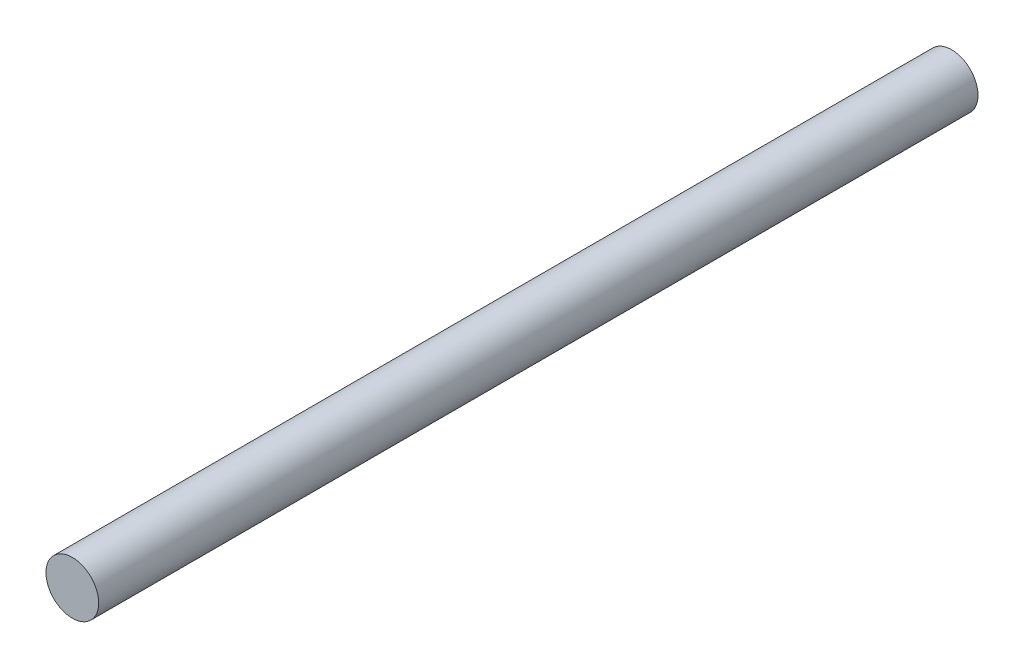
SolidWorks part; units mm, degrees
ref_plane "Front Plane" through (0, 0, 0) normal (0, 0, 1) x (1, 0, 0)
ref_plane "Top Plane" through (0, 0, 0) normal (0, 1, 0) x (1, 0, 0)
ref_plane "Right Plane" through (0, 0, 0) normal (1, 0, 0) x (0, 0, -1)
sketch "Sketch1" plane through (0, 0, 0) normal (0, 0, 1) x (1, 0, 0)
  circle A0 centre (0, 0) radius 30
  dimension "D1" = 60
extrude "Boss-Extrude1" add sketch "Sketch1" against normal blind 1000
